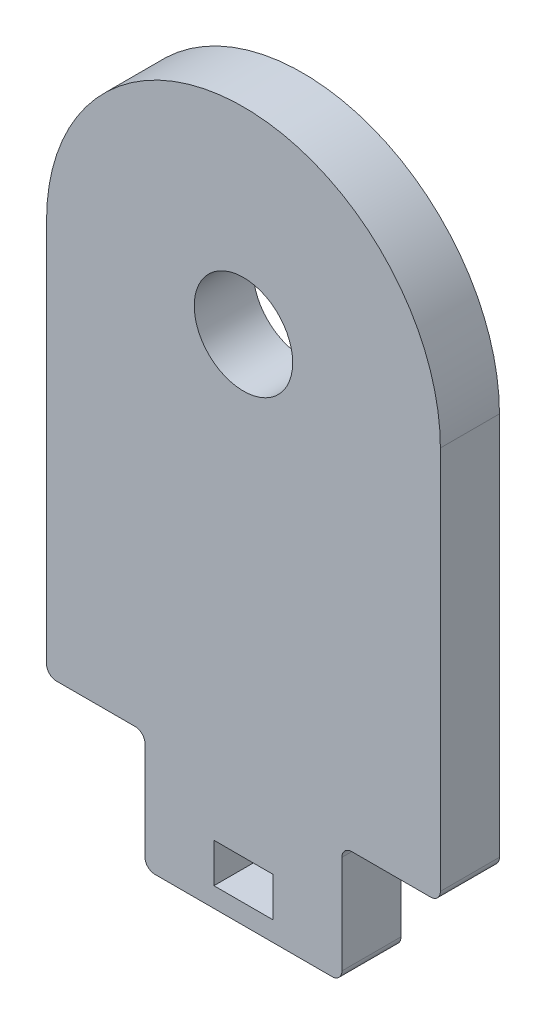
SolidWorks part; units mm, degrees
ref_plane "Front Plane" through (0, 0, 0) normal (0, 0, 1) x (1, 0, 0)
ref_plane "Top Plane" through (0, 0, 0) normal (0, 1, 0) x (1, 0, 0)
ref_plane "Right Plane" through (0, 0, 0) normal (1, 0, 0) x (0, 0, -1)
sketch "Sketch1" plane through (0, 0, 0) normal (0, 0, 1) x (1, 0, 0)
  line L0 (-10, 0) -> (10, 0)
  line L1 (-10, 0) -> (-10, 12)
  line L2 (-10, 12) -> (-20, 12)
  line L3 (-20, 12) -> (-20, 52)
  line L4 (0, 0) -> (0, 52) construction
  line L5 (20, 12) -> (20, 52)
  line L6 (10, 12) -> (20, 12)
  line L7 (10, 0) -> (10, 12)
  line L8 (-10, 6) -> (10, 6) construction
  line L9 (-8.3278, 6) -> (-8.3278, 0) construction
  line L10 (-3, 6) -> (3, 6)
  line L11 (-3, 6) -> (-3, 2)
  line L12 (-3, 2) -> (3, 2)
  line L13 (3, 6) -> (3, 2)
  line L14 (-3, 6) -> (3, 2) construction
  line L15 (-3, 2) -> (3, 6) construction
  arc A0 (-20, 52) -> (20, 52) centre (0, 52) cw
  point P4 (0, 0)
  point P15 (0, 4)
  dimension "D1" = 12
  dimension "D2" = 10
  dimension "D3" = 10
  dimension "D4" = 40
  dimension "D5" = 6
  dimension "D6" = 6
  dimension "D7" = 4
extrude "Boss-Extrude1" add sketch "Sketch1" along normal blind 6
fillet "Fillet1" radius 1 6 edges at (-20, 12, 3) (-10, 12, 3) (-10, 0, 3) (20, 12, 3) (10, 0, 3) (10, 12, 3)
sketch "Sketch2" plane through (0, 0, 6) normal (0, 0, 1) x (1, 0, 0)
  circle A0 centre (0, 52) radius 5
  dimension "D1" = 10
extrude "Cut-Extrude1" cut sketch "Sketch2" against normal through all
